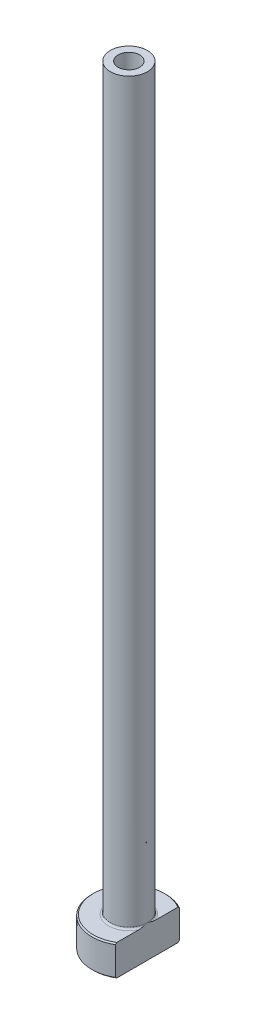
SolidWorks part; units mm, degrees
ref_plane "Front Plane" through (0, 0, 0) normal (0, 0, 1) x (1, 0, 0)
ref_plane "Top Plane" through (0, 0, 0) normal (0, 1, 0) x (1, 0, 0)
ref_plane "Right Plane" through (0, 0, 0) normal (1, 0, 0) x (0, 0, -1)
sketch "Sketch1" plane through (0, 0, 0) normal (0, 0, 1) x (1, 0, 0)
  line L0 (-1.75, 125) -> (-3, 125)
  line L1 (-3, 125) -> (-3, 5)
  line L2 (-3, 5) -> (-6, 5)
  line L3 (-6, 5) -> (-6, 0)
  line L4 (4.95, 0) -> (-4.95, 0) construction
  line L5 (-6, 0) -> (-2, 0)
  line L6 (-1.75, 80) -> (-1.75, 125)
  line L7 (0, 92.1877) -> (0, -15.5353) construction
  line L8 (0, -6.6) -> (0, 6.6) construction
  line L9 (-1.75, 80) -> (-2, 68)
  line L10 (-2, 68) -> (-2, 0)
  dimension "D1" = 0.25
  dimension "ID" = 3.5
  dimension "OD" = 6
  dimension "L" = 125
  dimension "H" = 12
  dimension "T" = 5
  dimension "N" = 45
  dimension "D2" = 12
  dimension "L-N" = 80
revolve "Revolve1" add sketch "Sketch1" angle 360 about L7
fillet "Fillet1" radius 0.3 1 edges at (0, 5, 3)
chamfer "Chamfer1" distance 0.2 angle 45 2 edges at (0, 5, 6) (0, 0, 6)
sketch "Sketch2" plane through (0, 0, 0) normal (0, -1, 0) x (1, 0, 0)
  line L0 (3, 5.1962) -> (3, -5.1962)
  circle A0 centre (0, 0) radius 6 construction
  arc A1 (3, 5.1962) -> (3, -5.1962) centre (0, 0) cw
  circle A2 centre (0, 0) radius 3 construction
extrude "Cut-Extrude1" cut sketch "Sketch2" against normal through all
chamfer "Chamfer2" distance 0.5 angle 45 1 edges at (0, 0, 2)
